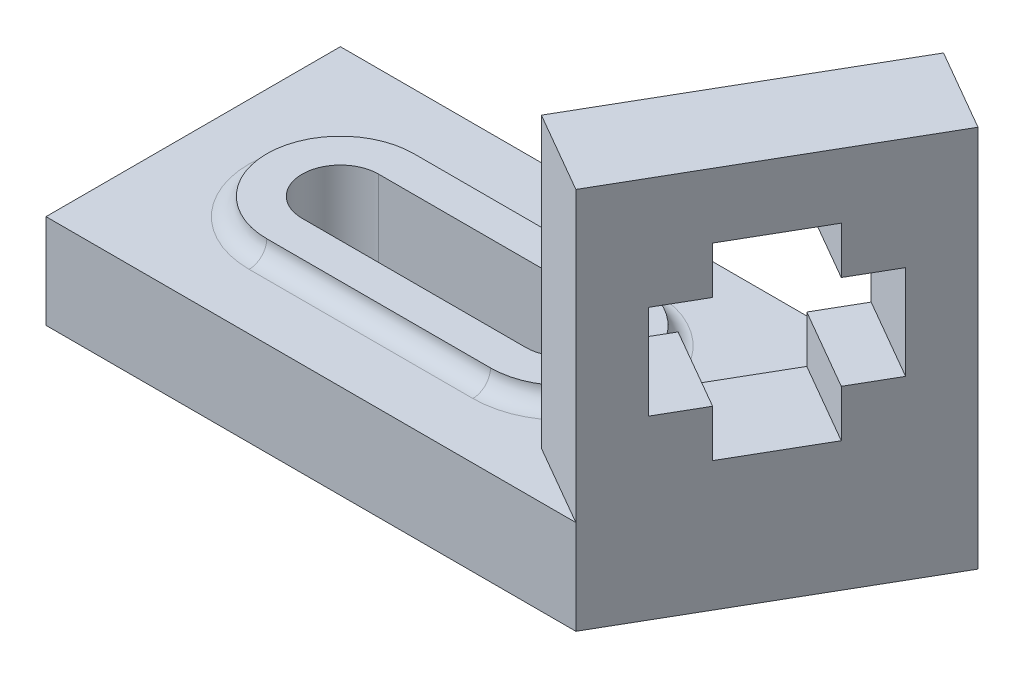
SolidWorks part; units mm, degrees
ref_plane "Front Plane" through (0, 0, 0) normal (0, 0, 1) x (1, 0, 0)
ref_plane "Top Plane" through (0, 0, 0) normal (0, 1, 0) x (1, 0, 0)
ref_plane "Right Plane" through (0, 0, 0) normal (1, 0, 0) x (0, 0, -1)
sketch "Sketch1" plane through (0, 0, 0) normal (0, 1, 0) x (1, 0, 0)
  line L0 (90, 0) -> (115, 43.3013)
  line L1 (0, 0) -> (90, 0)
  line L2 (0, 0) -> (0, 50)
  line L3 (0, 50) -> (90, 50)
  line L5 (90, 0) -> (129.4044, 0) construction
  line L6 (115, 43.3013) -> (101.1436, 51.3013)
  line L7 (101.1436, 51.3013) -> (90, 50)
  dimension "D1" = 60
  dimension "D2" = 50
  dimension "D3" = 90
  dimension "D4" = 50
  dimension "D5" = 16
extrude "Boss-Extrude1" add sketch "Sketch1" along normal blind 16
sketch "Sketch2" plane through (67.5, 0, 38.9711) normal (0.866, 0, 0.5) x (0.5, 0, -0.866)
  line L0 (45, 0) -> (95, 0) construction
  line L1 (45, 16) -> (95, 16)
  line L2 (45, 16) -> (45, 65)
  line L3 (45, 65) -> (95, 65)
  line L4 (95, 16) -> (95, 65)
  line L5 (78, 46) -> (86, 46)
  line L6 (54, 46) -> (62, 46)
  line L7 (54, 46) -> (54, 30)
  line L8 (54, 30) -> (62, 30)
  line L9 (86, 46) -> (86, 30)
  line L10 (62, 54) -> (78, 54)
  line L11 (62, 54) -> (62, 46)
  line L12 (62, 22) -> (78, 22)
  line L13 (78, 54) -> (78, 46)
  line L14 (62, 30) -> (62, 22)
  line L15 (78, 30) -> (86, 30)
  line L16 (78, 30) -> (78, 22)
  point P19 (82, 46)
  dimension "D1" = 50
  dimension "D2" = 65
  dimension "D3" = 16
  dimension "D4" = 8
  dimension "D5" = 9
  dimension "D6" = 22
extrude "Boss-Extrude2" add sketch "Sketch2" against normal blind 16
sketch "Sketch3" plane through (0, 16, 0) normal (0, 1, 0) x (1, 0, 0)
  line L0 (0, 50) -> (0, 0) construction
  line L1 (25, 31.5) -> (63, 31.5)
  line L2 (25, 18.5) -> (63, 18.5)
  arc A0 (25, 31.5) -> (25, 18.5) centre (25, 25) ccw
  arc A1 (63, 18.5) -> (63, 31.5) centre (63, 25) ccw
  point P6 (0, 25)
  dimension "D1" = 13
  dimension "D2" = 38
  dimension "D3" = 25
extrude "Cut-Extrude1" cut sketch "Sketch3" against normal blind 16
sketch "Sketch4" plane through (0, 16, 0) normal (0, 1, 0) x (1, 0, 0)
  line L0 (25, 18.5) -> (63, 18.5) construction
  line L1 (63, 31.5) -> (25, 31.5) construction
  line L2 (25, 18.5) -> (63, 18.5)
  line L3 (63, 31.5) -> (25, 31.5)
  line L4 (63, 37.5) -> (25, 37.5)
  line L5 (25, 12.5) -> (63, 12.5)
  arc A0 (25, 31.5) -> (25, 18.5) centre (25, 25) ccw construction
  arc A1 (63, 18.5) -> (63, 31.5) centre (63, 25) ccw construction
  arc A2 (25, 31.5) -> (25, 18.5) centre (25, 25) ccw
  arc A3 (63, 18.5) -> (63, 31.5) centre (63, 25) ccw
  arc A4 (25, 37.5) -> (25, 12.5) centre (25, 25) ccw
  arc A5 (63, 12.5) -> (63, 37.5) centre (63, 25) ccw
  dimension "D1" = 6
extrude "Boss-Extrude3" add sketch "Sketch4" along normal blind 3
fillet "Fillet1" radius 3 4 edges at (44, 16, -37.5) (75.5, 16, -25) (44, 16, -12.5) (12.5, 16, -25)
